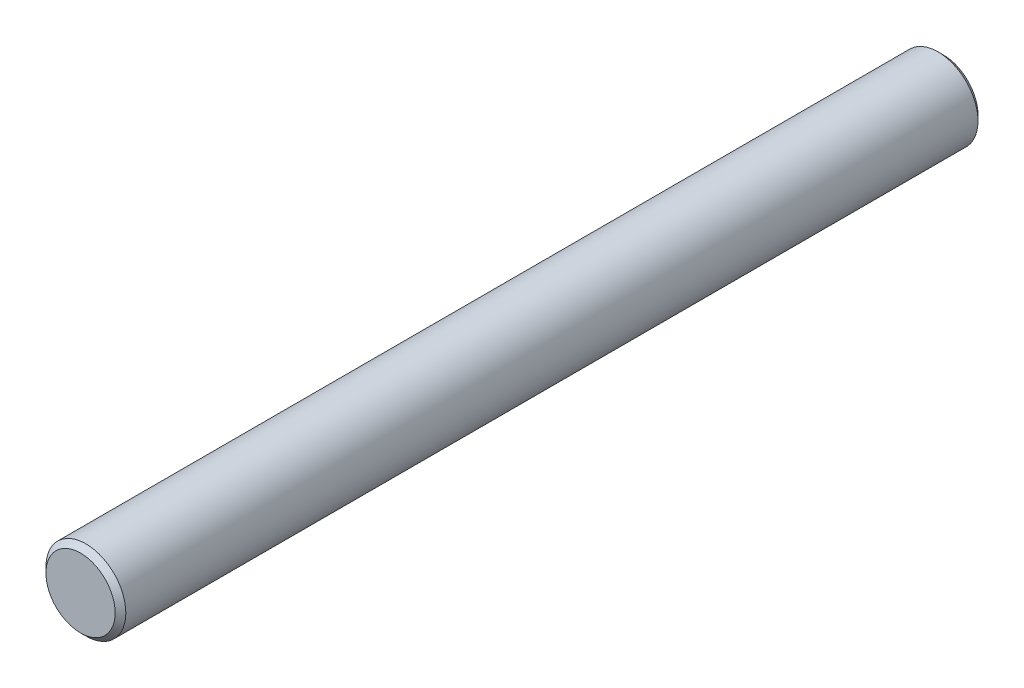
SolidWorks part; units mm, degrees
ref_plane "Plan de face" through (0, 0, 0) normal (0, 0, 1) x (1, 0, 0)
ref_plane "Plan de dessus" through (0, 0, 0) normal (0, 1, 0) x (1, 0, 0)
ref_plane "Plan de droite" through (0, 0, 0) normal (1, 0, 0) x (0, 0, -1)
sketch "Esquisse1" plane through (0, 0, 0) normal (0, 0, 1) x (1, 0, 0)
  circle A0 centre (0, 0) radius 1.5
  dimension "D1" = 3
extrude "Extrusion1" add sketch "Esquisse1" along normal blind 32.4
chamfer "Chanfrein1" distance 0.2 angle 45 2 edges at (1.5, 0, 0) (1.5, 0, 32.4)
